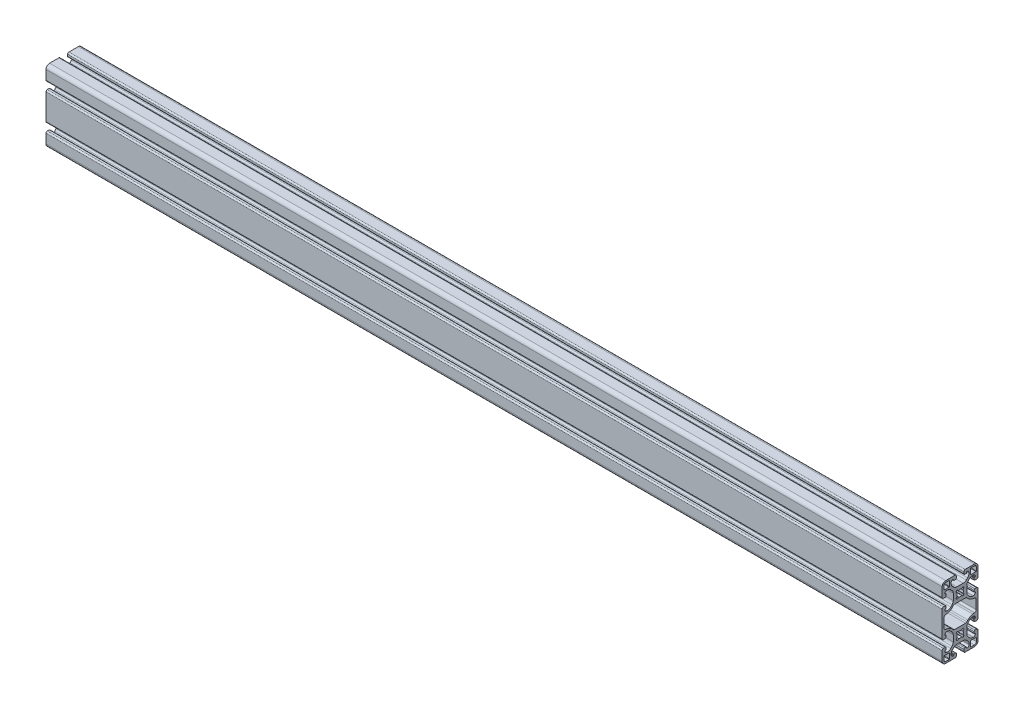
SolidWorks part; units mm, degrees
ref_plane "Front Plane" through (0, 0, 0) normal (0, 0, 1) x (1, 0, 0)
ref_plane "Top Plane" through (0, 0, 0) normal (0, 1, 0) x (1, 0, 0)
ref_plane "Right Plane" through (0, 0, 0) normal (1, 0, 0) x (0, 0, -1)
sketch "Sketch1" plane through (0, 0, 0) normal (0, 0, 1) x (1, 0, 0)
  line L0 (0, 0) -> (1000, 0)
  dimension "D1" = 1000
other "40-sarja 1.0070 40X80(1)"
ref_plane "Plane1" through (0, 0, 0) normal (1, 0, 0) x (0, -1, 0)
sketch "Model6" plane through (0, 0, 0) normal (1, 0, 0) x (0, -1, 0)
  line L0 (-13.35, 15.5) -> (-14.85, 15.5)
  line L1 (-31.8, 17.7) -> (-31.8, 12.3)
  line L2 (-37.7, -11.8) -> (-32.3, -11.8)
  line L3 (37.7, 11.8) -> (32.3, 11.8)
  line L4 (31.8, -17.7) -> (31.8, -12.3)
  line L5 (15.75, 3.5428) -> (16.4572, 4.25)
  line L6 (-15.75, -3.5428) -> (-16.4572, -4.25)
  line L7 (10.4215, 8.7004) -> (11.6161, 7.5833)
  line L8 (-32.3, 11.8) -> (-37.7, 11.8)
  line L9 (-38.2, 12.3) -> (-38.2, 16)
  line L10 (-36, 18.2) -> (-32.3, 18.2)
  line L11 (-31.8, -12.3) -> (-31.8, -17.7)
  line L12 (-32.3, -18.2) -> (-36, -18.2)
  line L13 (-38.2, -16) -> (-38.2, -12.3)
  line L14 (31.8, 12.3) -> (31.8, 17.7)
  line L15 (32.3, 18.2) -> (36, 18.2)
  line L16 (38.2, 16) -> (38.2, 12.3)
  line L17 (32.3, -11.8) -> (37.7, -11.8)
  line L18 (38.2, -12.3) -> (38.2, -16)
  line L19 (36, -18.2) -> (32.3, -18.2)
  line L20 (17.1643, 4.25) -> (18.2249, 3.1893)
  line L21 (21.7751, 3.1893) -> (22.8357, 4.25)
  line L22 (23.5428, 4.25) -> (24.25, 3.5428)
  line L23 (24.25, 2.8357) -> (23.1893, 1.7751)
  line L24 (23.1893, -1.7751) -> (24.25, -2.8357)
  line L25 (24.25, -3.5428) -> (23.5428, -4.25)
  line L26 (22.8357, -4.25) -> (21.7751, -3.1893)
  line L27 (18.2249, -3.1893) -> (17.1643, -4.25)
  line L28 (16.4572, -4.25) -> (15.75, -3.5428)
  line L29 (15.75, -2.8357) -> (16.8107, -1.7751)
  line L30 (16.8107, 1.7751) -> (15.75, 2.8357)
  line L31 (-17.1643, -4.25) -> (-18.2249, -3.1893)
  line L32 (-21.7751, -3.1893) -> (-22.8357, -4.25)
  line L33 (-23.5428, -4.25) -> (-24.25, -3.5428)
  line L34 (-24.25, -2.8357) -> (-23.1893, -1.7751)
  line L35 (-23.1893, 1.7751) -> (-24.25, 2.8357)
  line L36 (-24.25, 3.5428) -> (-23.5428, 4.25)
  line L37 (-22.8357, 4.25) -> (-21.7751, 3.1893)
  line L38 (-18.2249, 3.1893) -> (-17.1643, 4.25)
  line L39 (-16.4572, 4.25) -> (-15.75, 3.5428)
  line L40 (-15.75, 2.8357) -> (-16.8107, 1.7751)
  line L41 (-16.8107, -1.7751) -> (-15.75, -2.8357)
  line L42 (12.25, 6.1226) -> (12.25, -6.1226)
  line L43 (11.6161, -7.5833) -> (10.4215, -8.7004)
  line L44 (7.4275, -14.1373) -> (7.104, -15.8394)
  line L45 (5.0501, -18) -> (-5.0501, -18)
  line L46 (-7.104, -15.8394) -> (-7.4275, -14.1373)
  line L47 (-10.4215, -8.7004) -> (-11.6161, -7.5833)
  line L48 (-12.25, -6.1226) -> (-12.25, 6.1226)
  line L49 (-11.6161, 7.5833) -> (-10.4215, 8.7004)
  line L50 (-7.4275, 14.1373) -> (-7.104, 15.8394)
  line L51 (-5.0501, 18) -> (5.0501, 18)
  line L52 (7.104, 15.8394) -> (7.4275, 14.1373)
  line L53 (-12.85, 16.5) -> (-12.85, 16)
  line L54 (-12.15, 17) -> (-12.35, 17)
  line L55 (-10, 14.0564) -> (-10, 14.85)
  line L56 (-13.0849, 8.948) -> (-11.6241, 10.314)
  line L57 (-23.5, 7.6) -> (-16.5, 7.6)
  line L58 (-28.3759, 10.314) -> (-26.9151, 8.948)
  line L59 (-30, 14.85) -> (-30, 14.0564)
  line L60 (-27.65, 17) -> (-27.85, 17)
  line L61 (-27.15, 16) -> (-27.15, 16.5)
  line L62 (-25.15, 15.5) -> (-26.65, 15.5)
  line L63 (-24.15, 18.5) -> (-24.15, 16.5)
  line L64 (-36, 20) -> (-25.65, 20)
  line L65 (-40, 5.65) -> (-40, 16)
  line L66 (-36.5, 4.15) -> (-38.5, 4.15)
  line L67 (-35.5, 6.65) -> (-35.5, 5.15)
  line L68 (-36.5, 7.15) -> (-36, 7.15)
  line L69 (-37, 7.85) -> (-37, 7.65)
  line L70 (-34.2033, 10) -> (-34.85, 10)
  line L71 (-29.0958, 6.9127) -> (-30.4608, 8.3744)
  line L72 (-27.75, -3.5) -> (-27.75, 3.5)
  line L73 (-30.4608, -8.3744) -> (-29.0958, -6.9127)
  line L74 (-34.85, -10) -> (-34.2033, -10)
  line L75 (-37, -7.65) -> (-37, -7.85)
  line L76 (-36, -7.15) -> (-36.5, -7.15)
  line L77 (-35.5, -5.15) -> (-35.5, -6.65)
  line L78 (-38.5, -4.15) -> (-36.5, -4.15)
  line L79 (-40, -16) -> (-40, -5.65)
  line L80 (-25.65, -20) -> (-36, -20)
  line L81 (-24.15, -16.5) -> (-24.15, -18.5)
  line L82 (-26.65, -15.5) -> (-25.15, -15.5)
  line L83 (-27.15, -16.5) -> (-27.15, -16)
  line L84 (-27.85, -17) -> (-27.65, -17)
  line L85 (-30, -14.0564) -> (-30, -14.85)
  line L86 (-26.9151, -8.948) -> (-28.3759, -10.314)
  line L87 (-16.5, -7.6) -> (-23.5, -7.6)
  line L88 (-11.6241, -10.314) -> (-13.0849, -8.948)
  line L89 (-10, -14.85) -> (-10, -14.0564)
  line L90 (-12.35, -17) -> (-12.15, -17)
  line L91 (-12.85, -16) -> (-12.85, -16.5)
  line L92 (-14.85, -15.5) -> (-13.35, -15.5)
  line L93 (-15.85, -18.5) -> (-15.85, -16.5)
  line L94 (14.35, -20) -> (-14.35, -20)
  line L95 (15.85, -16.5) -> (15.85, -18.5)
  line L96 (13.35, -15.5) -> (14.85, -15.5)
  line L97 (12.85, -16.5) -> (12.85, -16)
  line L98 (12.15, -17) -> (12.35, -17)
  line L99 (10, -14.0564) -> (10, -14.85)
  line L100 (13.0849, -8.948) -> (11.6241, -10.314)
  line L101 (23.5, -7.6) -> (16.5, -7.6)
  line L102 (28.3759, -10.314) -> (26.9151, -8.948)
  line L103 (30, -14.85) -> (30, -14.0564)
  line L104 (27.65, -17) -> (27.85, -17)
  line L105 (27.15, -16) -> (27.15, -16.5)
  line L106 (25.15, -15.5) -> (26.65, -15.5)
  line L107 (24.15, -18.5) -> (24.15, -16.5)
  line L108 (36, -20) -> (25.65, -20)
  line L109 (40, -5.65) -> (40, -16)
  line L110 (36.5, -4.15) -> (38.5, -4.15)
  line L111 (35.5, -6.65) -> (35.5, -5.15)
  line L112 (36.5, -7.15) -> (36, -7.15)
  line L113 (37, -7.85) -> (37, -7.65)
  line L114 (34.2033, -10) -> (34.85, -10)
  line L115 (29.0958, -6.9127) -> (30.4608, -8.3744)
  line L116 (27.75, 3.5) -> (27.75, -3.5)
  line L117 (30.4608, 8.3744) -> (29.0958, 6.9127)
  line L118 (34.85, 10) -> (34.2033, 10)
  line L119 (37, 7.65) -> (37, 7.85)
  line L120 (36, 7.15) -> (36.5, 7.15)
  line L121 (35.5, 5.15) -> (35.5, 6.65)
  line L122 (38.5, 4.15) -> (36.5, 4.15)
  line L123 (40, 16) -> (40, 5.65)
  line L124 (25.65, 20) -> (36, 20)
  line L125 (24.15, 16.5) -> (24.15, 18.5)
  line L126 (26.65, 15.5) -> (25.15, 15.5)
  line L127 (27.15, 16.5) -> (27.15, 16)
  line L128 (27.85, 17) -> (27.65, 17)
  line L129 (30, 14.0564) -> (30, 14.85)
  line L130 (26.9151, 8.948) -> (28.3759, 10.314)
  line L131 (16.5, 7.6) -> (23.5, 7.6)
  line L132 (11.6241, 10.314) -> (13.0849, 8.948)
  line L133 (10, 14.85) -> (10, 14.0564)
  line L134 (12.35, 17) -> (12.15, 17)
  line L135 (12.85, 16) -> (12.85, 16.5)
  line L136 (14.85, 15.5) -> (13.35, 15.5)
  line L137 (15.85, 18.5) -> (15.85, 16.5)
  line L138 (-14.35, 20) -> (14.35, 20)
  line L139 (-15.85, 16.5) -> (-15.85, 18.5)
  arc A0 (-32.3, 11.8) -> (-31.8, 12.3) centre (-32.3, 12.3) ccw
  arc A1 (-38.2, 12.3) -> (-37.7, 11.8) centre (-37.7, 12.3) ccw
  arc A2 (-36, 18.2) -> (-38.2, 16) centre (-36, 16) ccw
  arc A3 (-31.8, 17.7) -> (-32.3, 18.2) centre (-32.3, 17.7) ccw
  arc A4 (-31.8, -12.3) -> (-32.3, -11.8) centre (-32.3, -12.3) ccw
  arc A5 (-32.3, -18.2) -> (-31.8, -17.7) centre (-32.3, -17.7) ccw
  arc A6 (-38.2, -16) -> (-36, -18.2) centre (-36, -16) ccw
  arc A7 (-37.7, -11.8) -> (-38.2, -12.3) centre (-37.7, -12.3) ccw
  arc A8 (31.8, 12.3) -> (32.3, 11.8) centre (32.3, 12.3) ccw
  arc A9 (32.3, 18.2) -> (31.8, 17.7) centre (32.3, 17.7) ccw
  arc A10 (38.2, 16) -> (36, 18.2) centre (36, 16) ccw
  arc A11 (37.7, 11.8) -> (38.2, 12.3) centre (37.7, 12.3) ccw
  arc A12 (32.3, -11.8) -> (31.8, -12.3) centre (32.3, -12.3) ccw
  arc A13 (38.2, -12.3) -> (37.7, -11.8) centre (37.7, -12.3) ccw
  arc A14 (36, -18.2) -> (38.2, -16) centre (36, -16) ccw
  arc A15 (31.8, -17.7) -> (32.3, -18.2) centre (32.3, -17.7) ccw
  arc A16 (17.1643, 4.25) -> (16.4572, 4.25) centre (16.8107, 3.8964) ccw
  arc A17 (21.7751, 3.1893) -> (18.2249, 3.1893) centre (20, 0) ccw
  arc A18 (23.5428, 4.25) -> (22.8357, 4.25) centre (23.1893, 3.8964) ccw
  arc A19 (24.25, 2.8357) -> (24.25, 3.5428) centre (23.8964, 3.1893) ccw
  arc A20 (23.1893, -1.7751) -> (23.1893, 1.7751) centre (20, 0) ccw
  arc A21 (24.25, -3.5428) -> (24.25, -2.8357) centre (23.8964, -3.1893) ccw
  arc A22 (22.8357, -4.25) -> (23.5428, -4.25) centre (23.1893, -3.8964) ccw
  arc A23 (18.2249, -3.1893) -> (21.7751, -3.1893) centre (20, 0) ccw
  arc A24 (16.4572, -4.25) -> (17.1643, -4.25) centre (16.8107, -3.8964) ccw
  arc A25 (15.75, -2.8357) -> (15.75, -3.5428) centre (16.1036, -3.1893) ccw
  arc A26 (16.8107, 1.7751) -> (16.8107, -1.7751) centre (20, 0) ccw
  arc A27 (15.75, 3.5428) -> (15.75, 2.8357) centre (16.1036, 3.1893) ccw
  arc A28 (-17.1643, -4.25) -> (-16.4572, -4.25) centre (-16.8107, -3.8964) ccw
  arc A29 (-21.7751, -3.1893) -> (-18.2249, -3.1893) centre (-20, 0) ccw
  arc A30 (-23.5428, -4.25) -> (-22.8357, -4.25) centre (-23.1893, -3.8964) ccw
  arc A31 (-24.25, -2.8357) -> (-24.25, -3.5428) centre (-23.8964, -3.1893) ccw
  arc A32 (-23.1893, 1.7751) -> (-23.1893, -1.7751) centre (-20, 0) ccw
  arc A33 (-24.25, 3.5428) -> (-24.25, 2.8357) centre (-23.8964, 3.1893) ccw
  arc A34 (-22.8357, 4.25) -> (-23.5428, 4.25) centre (-23.1893, 3.8964) ccw
  arc A35 (-18.2249, 3.1893) -> (-21.7751, 3.1893) centre (-20, 0) ccw
  arc A36 (-16.4572, 4.25) -> (-17.1643, 4.25) centre (-16.8107, 3.8964) ccw
  arc A37 (-15.75, 2.8357) -> (-15.75, 3.5428) centre (-16.1036, 3.1893) ccw
  arc A38 (-16.8107, -1.7751) -> (-16.8107, 1.7751) centre (-20, 0) ccw
  arc A39 (-15.75, -3.5428) -> (-15.75, -2.8357) centre (-16.1036, -3.1893) ccw
  arc A40 (12.25, 6.1226) -> (11.6161, 7.5833) centre (10.2502, 6.1226) ccw
  arc A41 (11.6161, -7.5833) -> (12.25, -6.1226) centre (10.2502, -6.1226) ccw
  arc A42 (10.4215, -8.7004) -> (7.4275, -14.1373) centre (17.2517, -16.0044) ccw
  arc A43 (7.104, -15.8394) -> (7.0298, -16.2844) centre (16.9282, -17.7065) ccw
  arc A44 (5.0501, -18) -> (7.0298, -16.2844) centre (5.0501, -16) ccw
  arc A45 (-7.0298, -16.2844) -> (-5.0501, -18) centre (-5.0501, -16) ccw
  arc A46 (-7.0298, -16.2844) -> (-7.104, -15.8394) centre (-16.9282, -17.7065) ccw
  arc A47 (-7.4275, -14.1373) -> (-10.4215, -8.7004) centre (-17.2517, -16.0044) ccw
  arc A48 (-12.25, -6.1226) -> (-11.6161, -7.5833) centre (-10.2502, -6.1226) ccw
  arc A49 (-11.6161, 7.5833) -> (-12.25, 6.1226) centre (-10.2502, 6.1226) ccw
  arc A50 (-10.4215, 8.7004) -> (-7.4275, 14.1373) centre (-17.2517, 16.0044) ccw
  arc A51 (-7.104, 15.8394) -> (-7.0298, 16.2844) centre (-16.9282, 17.7065) ccw
  arc A52 (-5.0501, 18) -> (-7.0298, 16.2844) centre (-5.0501, 16) ccw
  arc A53 (7.0298, 16.2844) -> (5.0501, 18) centre (5.0501, 16) ccw
  arc A54 (7.0298, 16.2844) -> (7.104, 15.8394) centre (16.9282, 17.7065) ccw
  arc A55 (7.4275, 14.1373) -> (10.4215, 8.7004) centre (17.2517, 16.0044) ccw
  arc A56 (-13.35, 15.5) -> (-12.85, 16) centre (-13.35, 16) ccw
  arc A57 (-12.35, 17) -> (-12.85, 16.5) centre (-12.35, 16.5) ccw
  arc A58 (-10, 14.85) -> (-12.15, 17) centre (-12.15, 14.85) ccw
  arc A59 (-11.6241, 10.314) -> (-10, 14.0564) centre (-15.1237, 14.0564) ccw
  arc A60 (-16.5, 7.6) -> (-13.0849, 8.948) centre (-16.5, 12.6) ccw
  arc A61 (-26.9151, 8.948) -> (-23.5, 7.6) centre (-23.5, 12.6) ccw
  arc A62 (-30, 14.0564) -> (-28.3759, 10.314) centre (-24.8763, 14.0564) ccw
  arc A63 (-27.85, 17) -> (-30, 14.85) centre (-27.85, 14.85) ccw
  arc A64 (-27.15, 16.5) -> (-27.65, 17) centre (-27.65, 16.5) ccw
  arc A65 (-27.15, 16) -> (-26.65, 15.5) centre (-26.65, 16) ccw
  arc A66 (-25.15, 15.5) -> (-24.15, 16.5) centre (-25.15, 16.5) ccw
  arc A67 (-24.15, 18.5) -> (-25.65, 20) centre (-25.65, 18.5) ccw
  arc A68 (-36, 20) -> (-40, 16) centre (-36, 16) ccw
  arc A69 (-40, 5.65) -> (-38.5, 4.15) centre (-38.5, 5.65) ccw
  arc A70 (-36.5, 4.15) -> (-35.5, 5.15) centre (-36.5, 5.15) ccw
  arc A71 (-35.5, 6.65) -> (-36, 7.15) centre (-36, 6.65) ccw
  arc A72 (-37, 7.65) -> (-36.5, 7.15) centre (-36.5, 7.65) ccw
  arc A73 (-34.85, 10) -> (-37, 7.85) centre (-34.85, 7.85) ccw
  arc A74 (-30.4608, 8.3744) -> (-34.2033, 10) centre (-34.2033, 4.8793) ccw
  arc A75 (-27.75, 3.5) -> (-29.0958, 6.9127) centre (-32.75, 3.5) ccw
  arc A76 (-29.0958, -6.9127) -> (-27.75, -3.5) centre (-32.75, -3.5) ccw
  arc A77 (-34.2033, -10) -> (-30.4608, -8.3744) centre (-34.2033, -4.8793) ccw
  arc A78 (-37, -7.85) -> (-34.85, -10) centre (-34.85, -7.85) ccw
  arc A79 (-36.5, -7.15) -> (-37, -7.65) centre (-36.5, -7.65) ccw
  arc A80 (-36, -7.15) -> (-35.5, -6.65) centre (-36, -6.65) ccw
  arc A81 (-35.5, -5.15) -> (-36.5, -4.15) centre (-36.5, -5.15) ccw
  arc A82 (-38.5, -4.15) -> (-40, -5.65) centre (-38.5, -5.65) ccw
  arc A83 (-40, -16) -> (-36, -20) centre (-36, -16) ccw
  arc A84 (-25.65, -20) -> (-24.15, -18.5) centre (-25.65, -18.5) ccw
  arc A85 (-24.15, -16.5) -> (-25.15, -15.5) centre (-25.15, -16.5) ccw
  arc A86 (-26.65, -15.5) -> (-27.15, -16) centre (-26.65, -16) ccw
  arc A87 (-27.65, -17) -> (-27.15, -16.5) centre (-27.65, -16.5) ccw
  arc A88 (-30, -14.85) -> (-27.85, -17) centre (-27.85, -14.85) ccw
  arc A89 (-28.3759, -10.314) -> (-30, -14.0564) centre (-24.8763, -14.0564) ccw
  arc A90 (-23.5, -7.6) -> (-26.9151, -8.948) centre (-23.5, -12.6) ccw
  arc A91 (-13.0849, -8.948) -> (-16.5, -7.6) centre (-16.5, -12.6) ccw
  arc A92 (-10, -14.0564) -> (-11.6241, -10.314) centre (-15.1237, -14.0564) ccw
  arc A93 (-12.15, -17) -> (-10, -14.85) centre (-12.15, -14.85) ccw
  arc A94 (-12.85, -16.5) -> (-12.35, -17) centre (-12.35, -16.5) ccw
  arc A95 (-12.85, -16) -> (-13.35, -15.5) centre (-13.35, -16) ccw
  arc A96 (-14.85, -15.5) -> (-15.85, -16.5) centre (-14.85, -16.5) ccw
  arc A97 (-15.85, -18.5) -> (-14.35, -20) centre (-14.35, -18.5) ccw
  arc A98 (14.35, -20) -> (15.85, -18.5) centre (14.35, -18.5) ccw
  arc A99 (15.85, -16.5) -> (14.85, -15.5) centre (14.85, -16.5) ccw
  arc A100 (13.35, -15.5) -> (12.85, -16) centre (13.35, -16) ccw
  arc A101 (12.35, -17) -> (12.85, -16.5) centre (12.35, -16.5) ccw
  arc A102 (10, -14.85) -> (12.15, -17) centre (12.15, -14.85) ccw
  arc A103 (11.6241, -10.314) -> (10, -14.0564) centre (15.1237, -14.0564) ccw
  arc A104 (16.5, -7.6) -> (13.0849, -8.948) centre (16.5, -12.6) ccw
  arc A105 (26.9151, -8.948) -> (23.5, -7.6) centre (23.5, -12.6) ccw
  arc A106 (30, -14.0564) -> (28.3759, -10.314) centre (24.8763, -14.0564) ccw
  arc A107 (27.85, -17) -> (30, -14.85) centre (27.85, -14.85) ccw
  arc A108 (27.15, -16.5) -> (27.65, -17) centre (27.65, -16.5) ccw
  arc A109 (27.15, -16) -> (26.65, -15.5) centre (26.65, -16) ccw
  arc A110 (25.15, -15.5) -> (24.15, -16.5) centre (25.15, -16.5) ccw
  arc A111 (24.15, -18.5) -> (25.65, -20) centre (25.65, -18.5) ccw
  arc A112 (36, -20) -> (40, -16) centre (36, -16) ccw
  arc A113 (40, -5.65) -> (38.5, -4.15) centre (38.5, -5.65) ccw
  arc A114 (36.5, -4.15) -> (35.5, -5.15) centre (36.5, -5.15) ccw
  arc A115 (35.5, -6.65) -> (36, -7.15) centre (36, -6.65) ccw
  arc A116 (37, -7.65) -> (36.5, -7.15) centre (36.5, -7.65) ccw
  arc A117 (34.85, -10) -> (37, -7.85) centre (34.85, -7.85) ccw
  arc A118 (30.4608, -8.3744) -> (34.2033, -10) centre (34.2033, -4.8793) ccw
  arc A119 (27.75, -3.5) -> (29.0958, -6.9127) centre (32.75, -3.5) ccw
  arc A120 (29.0958, 6.9127) -> (27.75, 3.5) centre (32.75, 3.5) ccw
  arc A121 (34.2033, 10) -> (30.4608, 8.3744) centre (34.2033, 4.8793) ccw
  arc A122 (37, 7.85) -> (34.85, 10) centre (34.85, 7.85) ccw
  arc A123 (36.5, 7.15) -> (37, 7.65) centre (36.5, 7.65) ccw
  arc A124 (36, 7.15) -> (35.5, 6.65) centre (36, 6.65) ccw
  arc A125 (35.5, 5.15) -> (36.5, 4.15) centre (36.5, 5.15) ccw
  arc A126 (38.5, 4.15) -> (40, 5.65) centre (38.5, 5.65) ccw
  arc A127 (40, 16) -> (36, 20) centre (36, 16) ccw
  arc A128 (25.65, 20) -> (24.15, 18.5) centre (25.65, 18.5) ccw
  arc A129 (24.15, 16.5) -> (25.15, 15.5) centre (25.15, 16.5) ccw
  arc A130 (26.65, 15.5) -> (27.15, 16) centre (26.65, 16) ccw
  arc A131 (27.65, 17) -> (27.15, 16.5) centre (27.65, 16.5) ccw
  arc A132 (30, 14.85) -> (27.85, 17) centre (27.85, 14.85) ccw
  arc A133 (28.3759, 10.314) -> (30, 14.0564) centre (24.8763, 14.0564) ccw
  arc A134 (23.5, 7.6) -> (26.9151, 8.948) centre (23.5, 12.6) ccw
  arc A135 (13.0849, 8.948) -> (16.5, 7.6) centre (16.5, 12.6) ccw
  arc A136 (10, 14.0564) -> (11.6241, 10.314) centre (15.1237, 14.0564) ccw
  arc A137 (12.15, 17) -> (10, 14.85) centre (12.15, 14.85) ccw
  arc A138 (12.85, 16.5) -> (12.35, 17) centre (12.35, 16.5) ccw
  arc A139 (12.85, 16) -> (13.35, 15.5) centre (13.35, 16) ccw
  arc A140 (14.85, 15.5) -> (15.85, 16.5) centre (14.85, 16.5) ccw
  arc A141 (15.85, 18.5) -> (14.35, 20) centre (14.35, 18.5) ccw
  arc A142 (-14.35, 20) -> (-15.85, 18.5) centre (-14.35, 18.5) ccw
  arc A143 (-15.85, 16.5) -> (-14.85, 15.5) centre (-14.85, 16.5) ccw
  point P418 (-40, 20)
  point P419 (-40, -20)
  point P420 (40, -20)
  point P421 (40, 20)
  point P422 (0, 20)
  point P423 (0, -20)
  point P424 (-40, 0)
  point P425 (40, 0)
  point P426 (0, 0)
